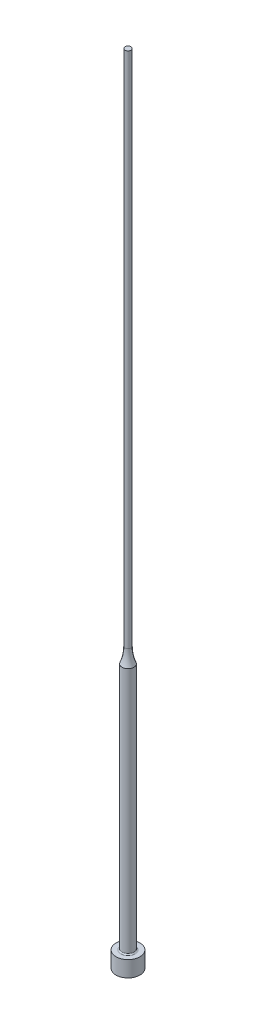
SolidWorks part; units mm, degrees
ref_plane "Front Plane" through (0, 0, 0) normal (0, 0, 1) x (1, 0, 0)
ref_plane "Top Plane" through (0, 0, 0) normal (0, 1, 0) x (1, 0, 0)
ref_plane "Right Plane" through (0, 0, 0) normal (1, 0, 0) x (0, 0, -1)
sketch "Sketch1" plane through (0, 0, 0) normal (0, 0, 1) x (1, 0, 0)
  line L0 (0, 0) -> (3, 0)
  line L1 (55, 0) -> (-55, 0) construction
  line L2 (3, 0) -> (3, 4)
  line L3 (3, 4) -> (1.8, 4)
  line L4 (1.5, 4.3) -> (1.5, 66.2003)
  line L6 (0.75, 70) -> (0.75, 200)
  line L7 (0.75, 200) -> (0, 200)
  line L8 (0, 200) -> (0, 0)
  arc A0 (0.75, 70) -> (1.5, 66.2003) centre (10.75, 70) ccw
  arc A1 (1.8, 4) -> (1.5, 4.3) centre (1.8, 4.3) cw
  dimension "D7" = 70
  dimension "D8" = 0.3
  dimension "D5" = 10
  dimension "D1" = 0.75
  dimension "D2" = 1.5
  dimension "D3" = 3
  dimension "D4" = 4
  dimension "D6" = 200
revolve "Revolve1" add sketch "Sketch1" angle 360 about L8
